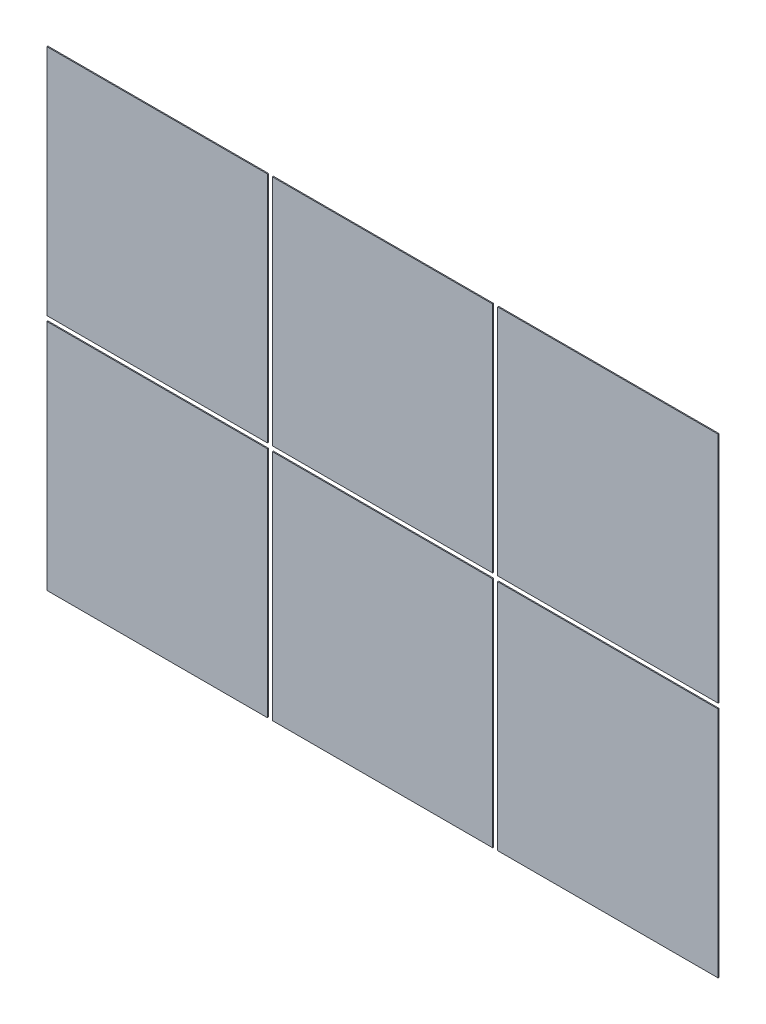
SolidWorks part; units mm, degrees
ref_plane "Top (Z)" through (0, 0, 0) normal (0, 0, 1) x (1, 0, 0)
ref_plane "Side (Y)" through (0, 0, 0) normal (0, 1, 0) x (1, 0, 0)
ref_plane "Front (X)" through (0, 0, 0) normal (1, 0, 0) x (0, 0, -1)
sketch "Sketch1" plane through (0, 0, 4.1) normal (0, 0, -1) x (-1, 0, 0)
  line L0 (-1340, -10) -> (-460, -10)
  line L1 (-1330, -20) -> (-470, -20) construction
  line L2 (-1330, -20) -> (-1330, -930) construction
  line L3 (-1330, -930) -> (-470, -930) construction
  line L4 (-470, -20) -> (-470, -930) construction
  line L5 (-430, -20) -> (430, -20) construction
  line L6 (-430, -20) -> (-430, -930) construction
  line L7 (-430, -930) -> (430, -930) construction
  line L8 (430, -20) -> (430, -930) construction
  line L9 (470, -930) -> (1330, -930) construction
  line L10 (470, -930) -> (470, -20) construction
  line L11 (470, -20) -> (1330, -20) construction
  line L12 (1330, -930) -> (1330, -20) construction
  line L13 (-1330, -970) -> (-470, -970) construction
  line L14 (-1330, -970) -> (-1330, -1880) construction
  line L15 (-1330, -1880) -> (-470, -1880) construction
  line L16 (-470, -970) -> (-470, -1880) construction
  line L17 (-430, -1880) -> (430, -1880) construction
  line L18 (-430, -1880) -> (-430, -970) construction
  line L19 (-430, -970) -> (430, -970) construction
  line L20 (430, -1880) -> (430, -970) construction
  line L21 (470, -970) -> (1330, -970) construction
  line L22 (470, -970) -> (470, -1880) construction
  line L23 (470, -1880) -> (1330, -1880) construction
  line L24 (1330, -970) -> (1330, -1880) construction
  line L25 (-460, -10) -> (-460, -940)
  line L26 (-1340, -940) -> (-460, -940)
  line L27 (-1340, -10) -> (-1340, -940)
  line L28 (-440, -10) -> (440, -10)
  line L29 (440, -10) -> (440, -940)
  line L30 (-440, -940) -> (440, -940)
  line L31 (-440, -10) -> (-440, -940)
  line L32 (460, -940) -> (1340, -940)
  line L33 (1340, -940) -> (1340, -10)
  line L34 (460, -10) -> (1340, -10)
  line L35 (460, -940) -> (460, -10)
  line L36 (-1340, -960) -> (-460, -960)
  line L37 (-460, -960) -> (-460, -1890)
  line L38 (-1340, -1890) -> (-460, -1890)
  line L39 (-1340, -960) -> (-1340, -1890)
  line L40 (-440, -1890) -> (440, -1890)
  line L41 (440, -1890) -> (440, -960)
  line L42 (-440, -960) -> (440, -960)
  line L43 (-440, -1890) -> (-440, -960)
  line L44 (460, -960) -> (1340, -960)
  line L45 (1340, -960) -> (1340, -1890)
  line L46 (460, -1890) -> (1340, -1890)
  line L47 (460, -960) -> (460, -1890)
  dimension "D1" = 10
extrude "Boss-Extrude1" add sketch "Sketch1" along normal blind 4
